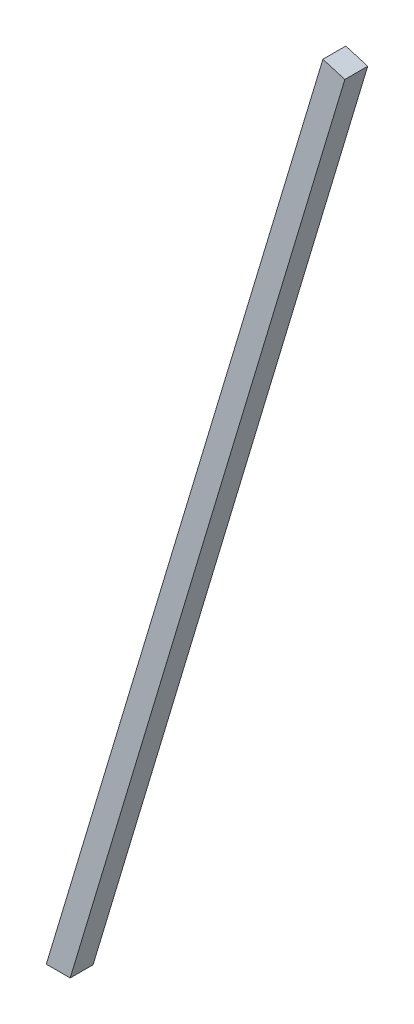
SolidWorks part; units mm, degrees
ref_plane "Plan de face" through (0, 0, 0) normal (0, 0, 1) x (1, 0, 0)
ref_plane "Plan de dessus" through (0, 0, 0) normal (0, 1, 0) x (1, 0, 0)
ref_plane "Plan de droite" through (0, 0, 0) normal (1, 0, 0) x (0, 0, -1)
sketch "Esquisse1" plane through (0, 0, 0) normal (0, 0, 1) x (1, 0, 0)
  line L0 (0, 0) -> (-10.4403, 0)
  line L1 (-10.4403, 0) -> (110.4217, 402.8735)
  line L2 (110.4217, 402.8735) -> (120, 400)
  line L3 (120, 400) -> (0, 0)
  dimension "D1" = 400
  dimension "D2" = 10
  dimension "D3" = 120
extrude "Extrusion1" add sketch "Esquisse1" along normal blind 10
